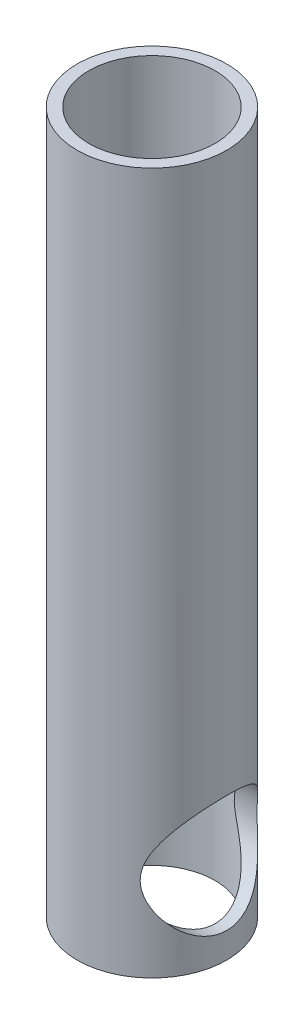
SolidWorks part; units mm, degrees
ref_plane "Front Plane" through (0, 0, 0) normal (0, 0, 1) x (1, 0, 0)
ref_plane "Top Plane" through (0, 0, 0) normal (0, 1, 0) x (1, 0, 0)
ref_plane "Right Plane" through (0, 0, 0) normal (1, 0, 0) x (0, 0, -1)
sketch "Esquisse1" plane through (0, 0, 0) normal (0, 1, 0) x (1, 0, 0)
  circle A0 centre (0, 0) radius 16
  circle A1 centre (0, 0) radius 13.5
  dimension "D1" = 32
  dimension "D2" = 2.5
extrude "Boss.-Extru.1" add sketch "Esquisse1" against normal blind 150
sketch "Esquisse3" plane through (0, 0, 0) normal (1, 0, 0) x (0, 0, -1)
  line L0 (-16, -150) -> (16, -150) construction
  circle A0 centre (0, -132) radius 12.5
  dimension "D1" = 25
  dimension "D2" = 18
extrude "Enlèv. mat.-Extru.2" cut sketch "Esquisse3" along normal through all
